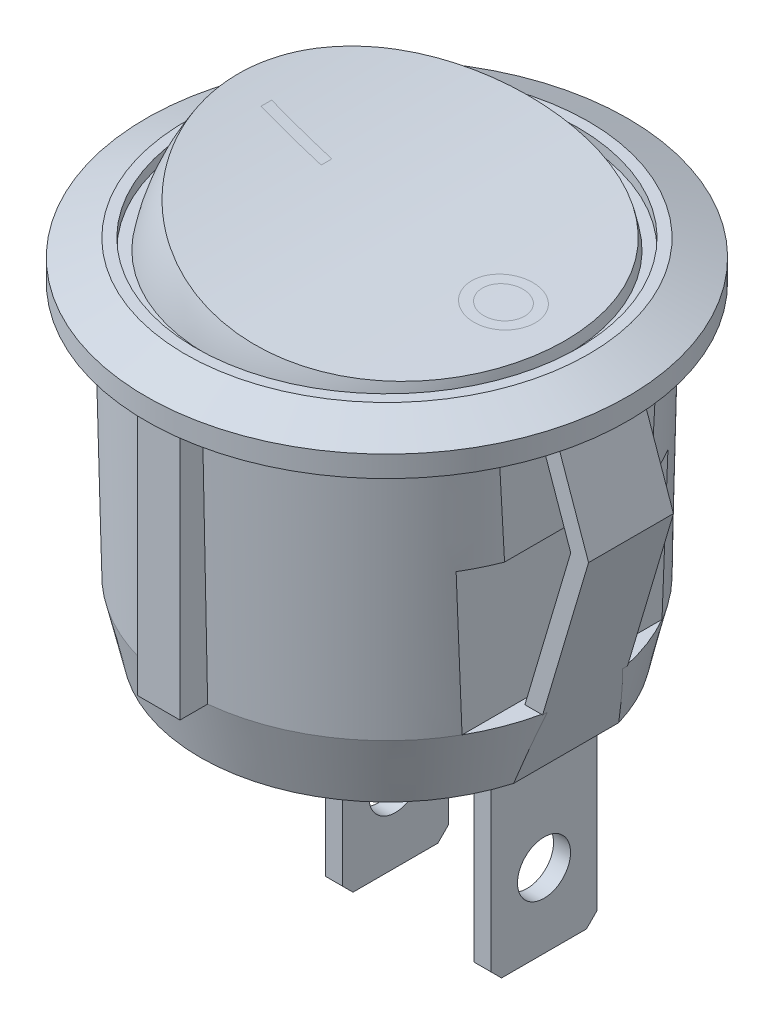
SolidWorks part; units mm, degrees
ref_plane "Plan de face" through (0, 0, 0) normal (0, 0, 1) x (1, 0, 0)
ref_plane "Plan de dessus" through (0, 0, 0) normal (0, 1, 0) x (1, 0, 0)
ref_plane "Plan de droite" through (0, 0, 0) normal (1, 0, 0) x (0, 0, -1)
sketch "Esquisse1" plane through (0, 0, 0) normal (0, 0, 1) x (1, 0, 0)
  line L0 (0, 0) -> (0, 16.4711) construction
  line L1 (-9, 1.8) -> (-9.5, 1.8)
  line L2 (-9.5, 1.8) -> (-11.35, 1)
  line L3 (-11.35, 1) -> (-11.35, 0)
  line L4 (-11.35, 0) -> (-9.75, 0)
  line L5 (-9.75, 0) -> (-9.5, -12)
  line L6 (-9.5, -12) -> (-8.8, -15)
  line L7 (-8.8, -15) -> (0, -15)
  line L8 (0, -15) -> (0, 5)
  line L9 (-9, 1.8) -> (-9, 1.3)
  line L10 (-9, 1.3) -> (-8.5, 1.3)
  line L11 (-7, 5) -> (0, 5)
  arc A0 (-8.5, 1.3) -> (-7, 5) centre (1.3309, -0.5314) cw
  point P16 (0, 4.8701)
  dimension "D14" = 10
  dimension "D1" = 22.7
  dimension "D2" = 19
  dimension "D3" = 1
  dimension "D4" = 1.8
  dimension "D5" = 19.5
  dimension "D6" = 19
  dimension "D7" = 16.8
  dimension "D8" = 3
  dimension "D9" = 17.6
  dimension "D10" = 20
  dimension "D11" = 18
  dimension "D12" = 17
  dimension "D13" = 0.5
  dimension "D15" = 14
revolve "Révolution1" add sketch "Esquisse1" angle 360 about L0
sketch "Esquisse2" plane through (0, 0, 0) normal (0, 0, 1) x (1, 0, 0)
  line L0 (-11.35, -12) -> (-8.25, -12)
  line L1 (-8.25, -12) -> (-8.25, -5.2)
  line L2 (-8.25, -5.2) -> (-9, -5.2)
  line L3 (-9, -5.2) -> (-9, 0)
  line L4 (-9.75, 0) -> (9.75, 0) construction
  line L5 (-9, 0) -> (-11.35, 0)
  line L6 (-11.35, 0) -> (11.35, 0) construction
  line L7 (-11.35, 0) -> (-11.35, -12)
  line L8 (-11.35, 1) -> (-11.35, 0) construction
  line L9 (0, 0) -> (0, 5.8821) construction
  line L10 (11.35, 0) -> (11.35, -12)
  line L11 (9, 0) -> (11.35, 0)
  line L12 (9, -5.2) -> (9, 0)
  line L13 (8.25, -5.2) -> (9, -5.2)
  line L14 (8.25, -12) -> (8.25, -5.2)
  line L15 (11.35, -12) -> (8.25, -12)
  line L16 (9.5, 1.8) -> (-9.5, 1.8) construction
  dimension "D1" = 16.5
  dimension "D2" = 18
  dimension "D3" = 7
extrude "Enlèv. mat.-Extru.1" cut sketch "Esquisse2" against normal through all and the other way through all
sketch "Esquisse3" plane through (0, 0, 0) normal (0, 0, 1) x (1, 0, 0)
  line L0 (-9, 0) -> (-10.6594, -4.7209)
  line L1 (-10.6594, -4.7209) -> (-8.5, -12)
  line L2 (-8.25, -12) -> (-9.5, -12) construction
  line L3 (-8.5, -12) -> (-9.3345, -12)
  line L4 (-9.3345, -12) -> (-11.5, -4.7)
  line L5 (-11.5, -4.7) -> (-9.848, 0)
  line L6 (-11.35, 0) -> (11.35, 0) construction
  line L7 (-9.848, 0) -> (-9, 0)
  line L8 (0, 0) -> (0, 5.41) construction
  line L9 (9.848, 0) -> (9, 0)
  line L10 (11.5, -4.7) -> (9.848, 0)
  line L11 (9.3345, -12) -> (11.5, -4.7)
  line L12 (8.5, -12) -> (9.3345, -12)
  line L13 (10.6594, -4.7209) -> (8.5, -12)
  line L14 (9, 0) -> (10.6594, -4.7209)
  line L15 (9.5, 1.8) -> (-9.5, 1.8) construction
  point P20 (-11.1479, -1.625)
  point P23 (-7.7, -12)
  point P24 (-8.4643, -12)
  dimension "D1" = 0.8
  dimension "D2" = 0.8
  dimension "D3" = 23
  dimension "D4" = 6.5
  dimension "D5" = 17
extrude "Boss.-Extru.1" add sketch "Esquisse3" along normal mid plane 4
sketch "Esquisse4" plane through (0, 0, 0) normal (0, 0, 1) x (1, 0, 0)
  line L0 (-9.5, -12) -> (-8.8, -15)
  line L1 (-8.8, -15) -> (-8.4445, -15)
  line L2 (-8.8, -15) -> (8.8, -15) construction
  line L3 (-8.4445, -15) -> (-9.3345, -12)
  line L4 (-9.3345, -12) -> (-9.5, -12)
  line L5 (9.3345, -12) -> (8.4445, -15)
  line L6 (8.4445, -15) -> (8.8, -15)
  line L7 (8.8, -15) -> (9.5, -12)
  line L8 (9.5, -12) -> (9.3345, -12)
  line L9 (9.3345, -12) -> (11.5, -4.7) construction
  line L10 (-11.5, -4.7) -> (-9.3345, -12) construction
extrude "Enlèv. mat.-Extru.2" cut sketch "Esquisse4" against normal through all and the other way through all
sketch "Esquisse5" plane through (0, 0, 0) normal (0, -1, 0) x (-1, 0, 0)
  line L1 (1, -8.743) -> (-1, -8.743)
  line L2 (1, -8.743) -> (1, -10.75)
  line L3 (1, -10.75) -> (-1, -10.75)
  line L4 (-1, -8.743) -> (-1, -10.75)
  arc A0 (-8.4445, -2.4759) -> (8.4445, -2.4759) centre (0, 0) ccw construction
  arc A1 (9, 3.75) -> (-9, 3.75) centre (0, 0) ccw construction
  point P7 (-2.7723, -8.3519)
  dimension "D1" = 2
  dimension "D2" = 20.5
extrude "Boss.-Extru.2" add sketch "Esquisse5" along normal up to vertex
sketch "Esquisse6" plane through (0, 0, 0) normal (0, 0, 1) x (1, 0, 0)
  line L0 (9, 1.8) -> (-9, 1.8) construction
  line L1 (-7, 5) -> (8.3936, 1.8) construction
  circle A0 centre (8.3936, 40.4253) radius 38.6253
  arc A1 (8.5, 1.3) -> (7, 5) centre (-1.3309, -0.5314) ccw construction
  arc A2 (-7, 5) -> (-8.5, 1.3) centre (1.3309, -0.5314) ccw construction
  point P5 (-7.0293, 5.0128)
  point P6 (8.3936, 1.8)
  point P12 (-7.1922, 5.0842)
extrude "Enlèv. mat.-Extru.3" cut sketch "Esquisse6" against normal through all and the other way through all
ref_plane "Plan1" through (0.7064, 3.398, 0) normal (-0.2035, -0.9791, 0) x (0.9791, -0.2035, 0)
sketch "Esquisse7" plane through (0.7064, 3.398, 0) normal (-0.2035, -0.9791, 0) x (0.9791, -0.2035, 0)
  line L0 (5, 0) -> (-5, 0) construction
  line L2 (-3.5, 0.25) -> (-6.5, 0.25)
  line L3 (-3.5, 0.25) -> (-3.5, -0.25)
  line L4 (-3.5, -0.25) -> (-6.5, -0.25)
  line L5 (-6.5, 0.25) -> (-6.5, -0.25)
  line L6 (-3.5, 0.25) -> (-6.5, -0.25) construction
  line L7 (-3.5, -0.25) -> (-6.5, 0.25) construction
  circle A0 centre (5, 0) radius 1.5
  circle A1 centre (5, 0) radius 1
  point P9 (4.9976, 0)
  point P10 (4.9969, 0)
  point P11 (4.9921, 0)
  point P12 (-3.7425, 3.3156)
  point P13 (-0.9435, 4.9102)
  point P14 (2.4364, 4.3662)
  point P15 (4.4465, 2.2865)
  point P16 (4.9032, 0.4544)
  dimension "D3" = 3
  dimension "D4" = 0.5
  dimension "D1" = 3
  dimension "D2" = 0.5
  dimension "D5" = 10
wrap "Enroulement1" sketch "Esquisse7" wrap type scribe source sketch "Esquisse7"
sketch "Esquisse8" plane through (0, 0, 0) normal (1, 0, 0) x (0, 0, -1)
  line L0 (0, 0) -> (0, -23.2569) construction
  line L1 (2.5, -15) -> (-2.5, -15)
  line L2 (2.4759, -15) -> (-2.4759, -15) construction
  line L3 (-2.5, -15) -> (-2.5, -23.2)
  line L4 (-2.5, -23.2) -> (-2, -23.7)
  line L5 (-2, -23.7) -> (2, -23.7)
  line L6 (2, -23.7) -> (2.5, -23.2)
  line L7 (2.5, -23.2) -> (2.5, -15)
  line L8 (9.5, 1.8) -> (-9.5, 1.8) construction
  circle A0 centre (0, -20.2) radius 1.25
  dimension "D5" = 2.5
  dimension "D1" = 5
  dimension "D2" = 25.5
  dimension "D3" = 0.5
  dimension "D4" = 45
  dimension "D6" = 3.5
extrude "Boss.-Extru.3" add sketch "Esquisse8" along normal mid plane 0.8
pattern_linear "Répétition linéaire1" count 2 spacing 7 along (1, 0, 0) of "Boss.-Extru.3"
